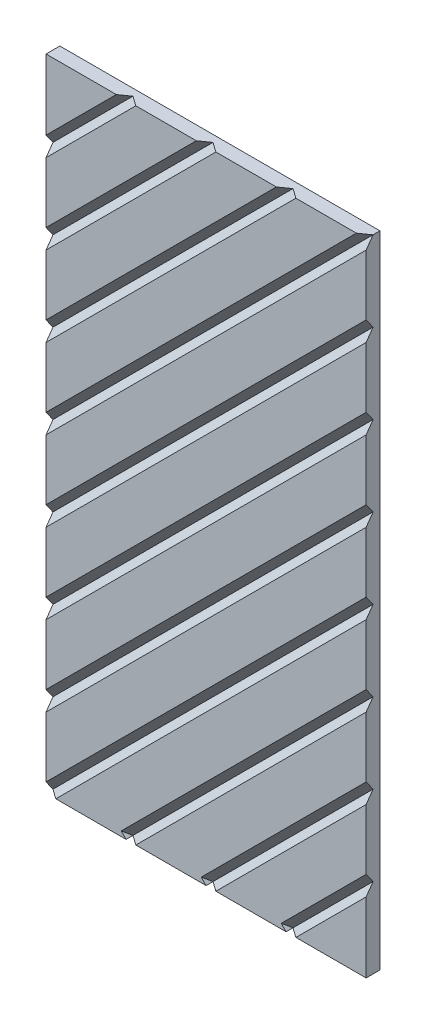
SolidWorks part; units mm, degrees
ref_plane "Front Plane" through (0, 0, 0) normal (0, 0, 1) x (1, 0, 0)
ref_plane "Top Plane" through (0, 0, 0) normal (0, 1, 0) x (1, 0, 0)
ref_plane "Right Plane" through (0, 0, 0) normal (1, 0, 0) x (0, 0, -1)
sketch "Sketch1" plane through (0, 0, 0) normal (0, 0, 1) x (1, 0, 0)
  line L1 (-290, 580) -> (290, 580)
  line L2 (-290, 580) -> (-290, -580)
  line L3 (-290, -580) -> (290, -580)
  line L4 (290, 580) -> (290, -580)
  point P4 (-290, 0)
  point P6 (0, 580)
  dimension "D1" = 580
  dimension "D2" = 1160
extrude "Boss-Extrude1" add sketch "Sketch1" along normal blind 25
ref_plane "Plane1" through (-435, -435, 0) normal (-0.7071, -0.7071, 0) x (0, 0, -1)
sketch "Sketch6" plane through (-435, -435, 0) normal (-0.7071, -0.7071, 0) x (0, 0, -1)
  line L0 (-12.5, 205.061) -> (-39.8765, 177.6845)
  line L1 (-25, 205.061) -> (0, 205.061) construction
  line L2 (-39.8765, 177.6845) -> (-39.8765, 232.4375)
  line L3 (-39.8765, 232.4375) -> (-12.5, 205.061)
  point P4 (0, 0)
  dimension "D1" = 90
  dimension "D2" = 54.753
extrude "Cut-Extrude3" cut sketch "Sketch6" against normal through all
pattern_linear "LPattern3" count 4 spacing 145 along (0.7071, -0.7071, 0) count 8 spacing 145 along (-0.7071, 0.7071, 0) of "Cut-Extrude3"
